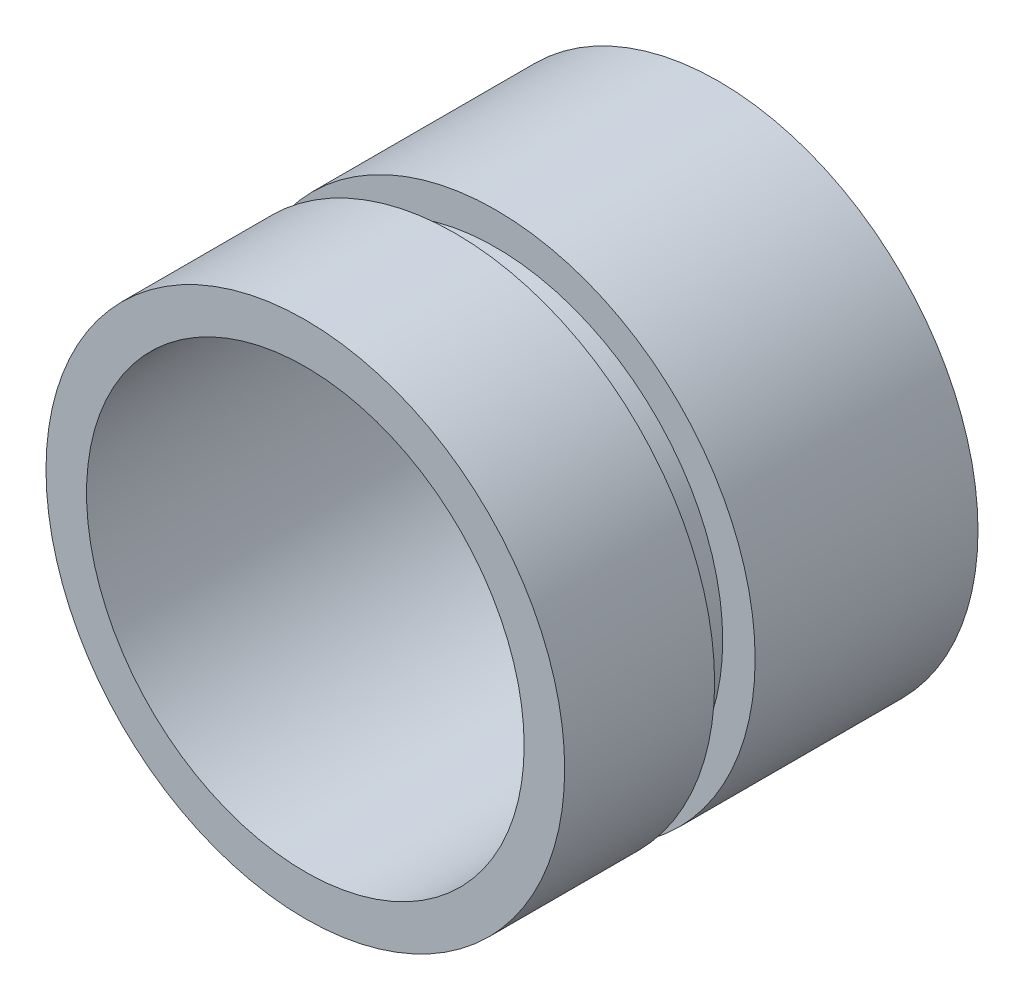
SolidWorks part; units mm, degrees
ref_plane "face" through (0, 0, 0) normal (0, 0, 1) x (1, 0, 0)
ref_plane "dessus" through (0, 0, 0) normal (0, 1, 0) x (1, 0, 0)
ref_plane "profil" through (0, 0, 0) normal (1, 0, 0) x (0, 0, -1)
sketch "Esquisse1" plane through (0, 0, 0) normal (0, 0, 1) x (1, 0, 0)
  circle A0 centre (0, 0) radius 13.5
  circle A1 centre (0, 0) radius 16
  dimension "D1" = 27
  dimension "D2" = 32
extrude "Base-Extrusion" add sketch "Esquisse1" along normal blind 25.5
sketch "Esquisse2" plane through (0, 0, 0) normal (1, 0, 0) x (0, 0, -1)
  line L0 (-25.5, 16) -> (-25.5, -16) construction
  line L1 (-16.25, 16.8732) -> (-13.75, 16.8732)
  line L2 (-16.25, 16.8732) -> (-16.25, 14)
  line L3 (-16.25, 14) -> (-13.75, 14)
  line L4 (-13.75, 16.8732) -> (-13.75, 14)
  line L5 (0, 16) -> (-25.5, 16) construction
  line L6 (-27.6402, 0) -> (8.1937, 0) construction
  line L7 (-25.5, 0) -> (0, 0) construction
  dimension "D1" = 2.5
  dimension "D2" = 9.25
  dimension "D3" = 2
revolve "Enlèvement de matière-Révolution1" cut sketch "Esquisse2" angle 360 about L6
